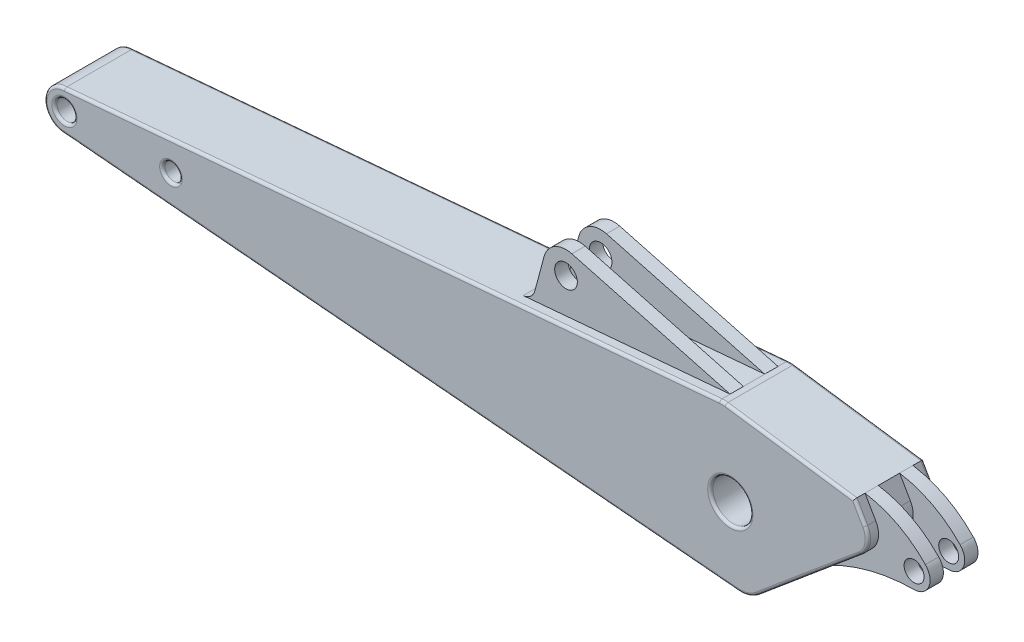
SolidWorks part; units mm, degrees
ref_plane "Front" through (0, 0, 0) normal (0, 0, 1) x (1, 0, 0)
ref_plane "Top" through (0, 0, 0) normal (0, 1, 0) x (1, 0, 0)
ref_plane "Right" through (0, 0, 0) normal (1, 0, 0) x (0, 0, -1)
sketch "Sketch1" plane through (0, 0, 0) normal (0, 0, 1) x (1, 0, 0)
  line L0 (0, 0) -> (3500, 0) construction
  line L1 (0, -75) -> (0, 75) construction
  line L2 (0, 75) -> (2459.2126, 290.1532)
  line L3 (0, -75) -> (2528.9186, -296.2517)
  line L4 (2481.8455, 289.5606) -> (2965.6969, 221.5597)
  line L5 (2965.6969, 221.5597) -> (3005.853, 152.0073)
  line L6 (2601.9129, -273.2367) -> (2987.9939, 50.7238)
  arc A0 (0, -75) -> (0, 75) centre (0, 0) cw
  arc A1 (2987.9939, 50.7238) -> (3005.853, 152.0073) centre (2936.5709, 112.0073) ccw
  arc A2 (2459.2126, 290.1532) -> (2481.8455, 289.5606) centre (2467.9282, 190.5338) cw
  arc A3 (2528.9186, -296.2517) -> (2601.9129, -273.2367) centre (2537.6342, -196.6322) ccw
  point P13 (2470.5629, 291.1462)
  point P16 (2570.1823, -299.8618)
  dimension "D7" = 8
  dimension "D11" = 80
  dimension "D12" = 100
  dimension "D1" = 3500
  dimension "D2" = 150
  dimension "D3" = 5
  dimension "D4" = 5
  dimension "D5" = 2480
  dimension "D6" = 2580
  dimension "D8" = 60
  dimension "D9" = 500
  dimension "D10" = 40
extrude "Extrude1" add sketch "Sketch1" along normal mid plane 260
sketch "Sketch2" plane through (0, 0, 130) normal (0, 0, 1) x (1, 0, 0)
  line L0 (0, 0) -> (3214.6013, 0) construction
  line L1 (400, 77.3684) -> (400, -60.0495) construction
  line L2 (2500, 160.8007) -> (2500, -192.5597) construction
  circle A0 centre (400, 0) radius 32.5
  circle A1 centre (2500, -20) radius 75
  circle A2 centre (0, 0) radius 37.5
  dimension "D3" = 75
  dimension "D4" = 65
  dimension "D5" = 150
  dimension "D6" = 20
  dimension "D1" = 400
  dimension "D2" = 2100
extrude "Cut-Extrude1" cut sketch "Sketch2" against normal through all
ref_plane "Plane1" through (0, 0, 40) normal (0, 0, 1) x (1, 0, 0)
sketch "Sketch3" plane through (0, 0, 40) normal (0, 0, 1) x (1, 0, 0)
  line L0 (2459.2126, 290.1532) -> (0, 75) construction
  line L1 (2459.2126, 290.1532) -> (1682.2457, 222.1774)
  line L2 (1761.0649, 389.2229) -> (1726.1842, 259.0462)
  line L3 (2459.2126, 290.1532) -> (1865.1683, 449.3269)
  arc A0 (1865.1683, 449.3269) -> (1761.0649, 389.2229) centre (1843.1686, 367.2232) ccw
  arc A1 (1682.2457, 222.1774) -> (1726.1842, 259.0462) centre (1677.8879, 271.9872) ccw
  circle A2 centre (1843.1686, 367.2232) radius 42.5
  point P6 (1783.0646, 471.3266)
  dimension "D2" = 85
  dimension "D4" = 100
  dimension "D5" = 85
  dimension "D1" = 700
  dimension "D3" = 20
extrude "Extrude2" add sketch "Sketch3" along normal blind 50
sketch "Sketch4" plane through (0, 0, 40) normal (0, 0, 1) x (1, 0, 0)
  line L0 (2500, -20) -> (2500, 60) construction
  line L1 (3150, 60) -> (3150, 0) construction
  line L2 (2500, 60) -> (3150, 60) construction
  line L3 (3150, 60) -> (3257.8108, 167.8108) construction
  line L4 (2601.9129, -273.2367) -> (2987.9939, 50.7238) construction
  line L6 (3005.853, 152.0073) -> (2965.6969, 221.5597) construction
  line L7 (2832.2034, -80) -> (2987.9939, 50.7238)
  line L9 (3005.853, 152.0073) -> (2965.6969, 221.5597)
  arc A0 (3150, 0) -> (3192.4264, 102.4264) centre (3150, 60) ccw
  circle A1 centre (3150, 60) radius 37.5
  arc A2 (3150, 0) -> (2832.2034, -80) centre (3157.2363, -699.9626) ccw
  arc A3 (2965.6969, 221.5597) -> (3192.4264, 102.4264) centre (2902.7983, -173.4641) cw
  arc A4 (2987.9939, 50.7238) -> (3005.853, 152.0073) centre (2936.5709, 112.0073) ccw construction
  arc A5 (2987.9939, 50.7238) -> (3005.853, 152.0073) centre (2936.5709, 112.0073) ccw
  dimension "D3" = 60
  dimension "D4" = 135
  dimension "D7" = 700
  dimension "D8" = 140
  dimension "D6" = 75
  dimension "D9" = 400
  dimension "D1" = 650
  dimension "D2" = 80
extrude "Extrude3" add sketch "Sketch4" along normal blind 50
mirror "Mirror1" about plane through (0, 0, 0) normal (0, 0, 1)
fillet "Fillet1" radius 10
